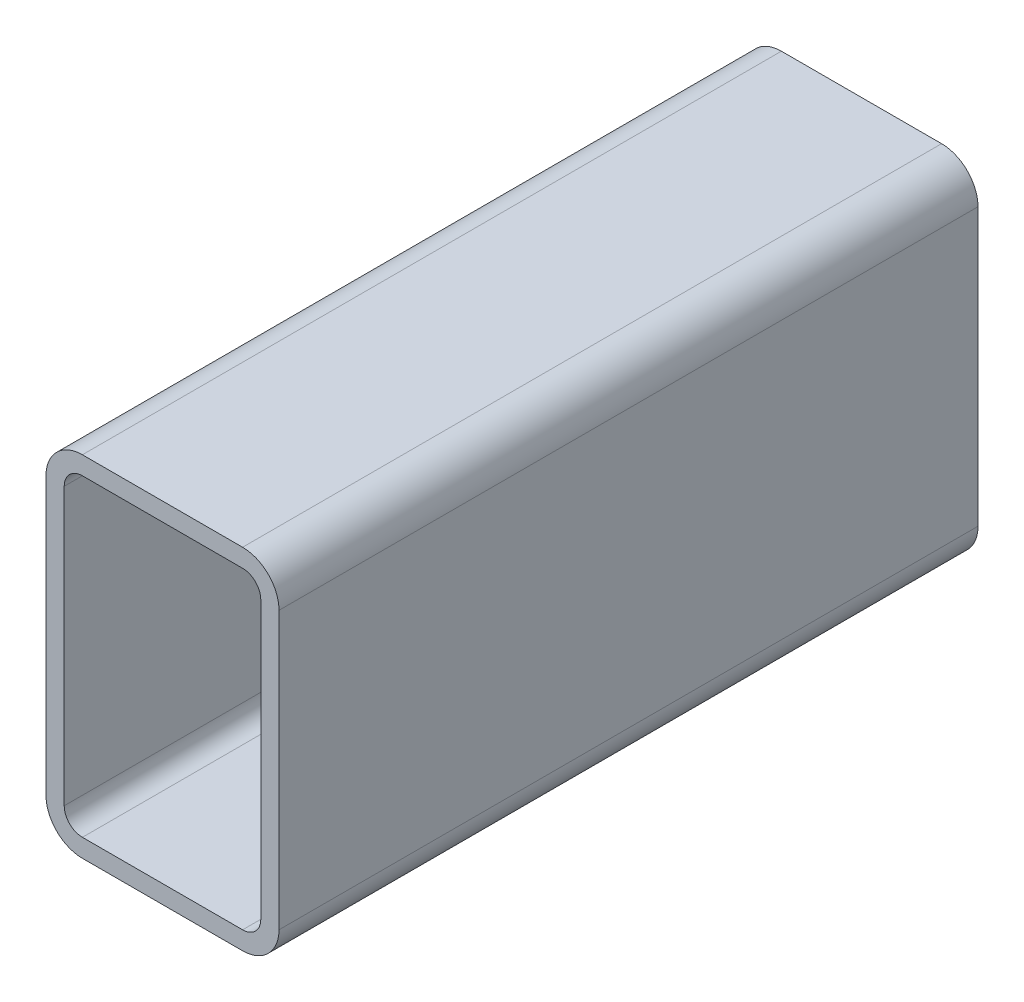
SolidWorks part; units mm, degrees
ref_plane "Front Plane" through (0, 0, 0) normal (0, 0, 1) x (1, 0, 0)
ref_plane "Top Plane" through (0, 0, 0) normal (0, 1, 0) x (1, 0, 0)
ref_plane "Right Plane" through (0, 0, 0) normal (1, 0, 0) x (0, 0, -1)
sketch "Sketch1" plane through (0, 0, 0) normal (0, 0, 1) x (1, 0, 0)
  point P0 (0, 0)
sketch_block_instance "HSS6x4x0.3125-1"
sketch_block "HSS6x4x0.3125"
extrude "Boss-Extrude1" add sketch "Sketch1" along normal blind 304.8
